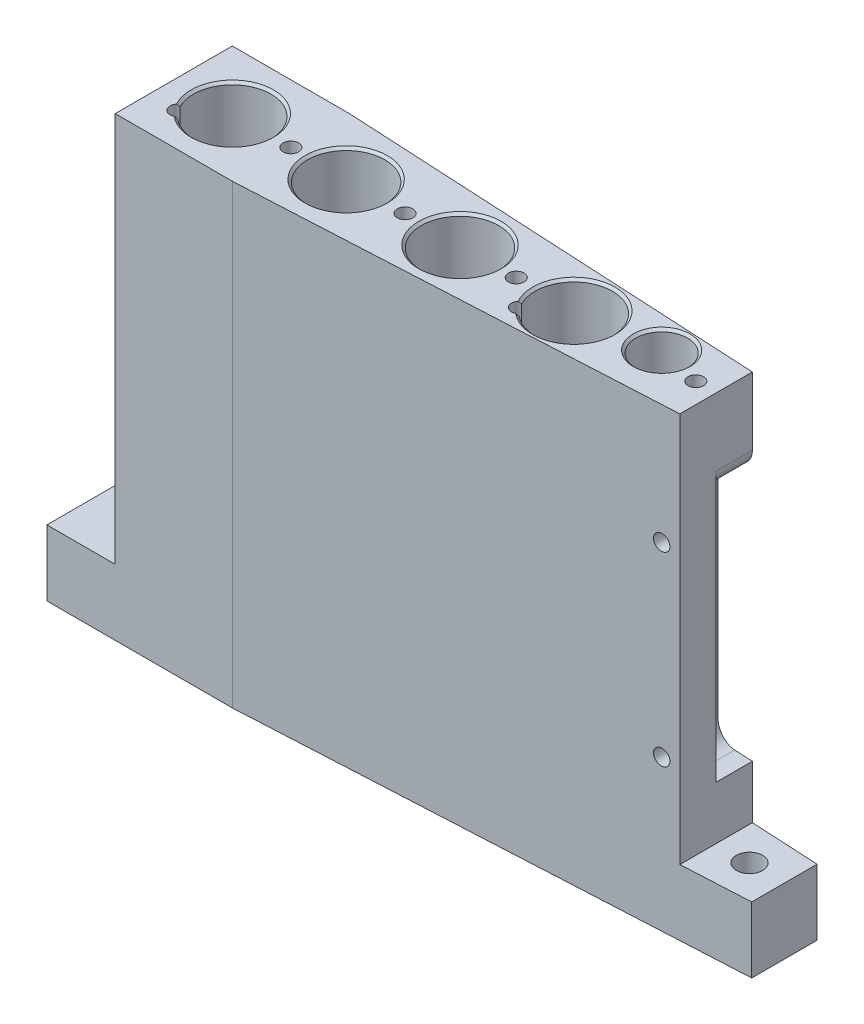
SolidWorks part; units mm, degrees
ref_plane "Front Plane" through (0, 0, 0) normal (0, 0, 1) x (1, 0, 0)
ref_plane "Top Plane" through (0, 0, 0) normal (0, 1, 0) x (1, 0, 0)
ref_plane "Right Plane" through (0, 0, 0) normal (1, 0, 0) x (0, 0, -1)
sketch "Sketch1" plane through (0, 0, 0) normal (0, 1, 0) x (1, 0, 0)
  line L0 (0, 6) -> (0, -6)
  line L2 (19.015, -6) -> (69.58, -3.35)
  line L3 (69.58, -3.35) -> (69.58, 3.35)
  line L4 (69.58, 3.35) -> (19.015, 6)
  line L5 (-7.8088, 0) -> (87.9118, 0) construction
  line L6 (-55, 0) -> (55, 0) construction
  line L7 (0, 6) -> (19.015, 6)
  line L8 (0, -6) -> (19.015, -6)
  point P0 (0, 0)
  dimension "D1" = 6
  dimension "D2" = 6.7
  dimension "D3" = 69.58
  dimension "D4" = 12
extrude "Boss-Extrude1" add sketch "Sketch1" along normal blind 46.75
hole_wizard "5/16 (0.3125) Diameter Hole1" positions "Sketch5" profile "Sketch4" hole size "5/16" standard "ANSI Inch"
sketch "Sketch5" plane through (-12.1053, 46.75, 2.0565) normal (0, 1, 0) x (-1, 0, 0)
  line L0 (-12.1053, 4.5435) -> (-12.1053, -8.6565) construction
  line L1 (13.6072, -2.0565) -> (-37.8178, -2.0565) construction
  point P0 (-25.1053, -2.0565)
  dimension "D1" = 13
sketch "Sketch4" plane through (13, 46.75, 0) normal (1, 0, 0) x (0, 0, 1)
  line L0 (0, 0) -> (0, 41)
  line L1 (0, 41) -> (3.9687, 41)
  line L2 (3.9687, 41) -> (3.9687, 0)
  line L5 (3.9687, 0) -> (0, 0)
  line L10 (0, 41) -> (-3.9688, 41) construction
  line L11 (0, -6.35) -> (0, 107.95) construction
  dimension "Hole Dia." = 7.9375
  dimension "Hole Depth" = 41
  dimension "Drill Angle" = 180
pattern_linear "LPattern1" count 4 spacing 11.6667 along (1, 0, 0) of "5/16 (0.3125) Diameter Hole1"
hole_wizard "#4 (0.209) Diameter Hole1" positions "Sketch13" profile "Sketch12" hole size "#4" standard "ANSI Inch"
sketch "Sketch13" plane through (0, 46.75, 0) normal (0, 1, 0) x (-1, 0, 0)
  line L1 (0, 6.6) -> (0, -6.6) construction
  line L2 (25.7125, 0) -> (-25.7125, 0) construction
  point P0 (-56, -1)
  dimension "D1" = 56
  dimension "D2" = 1
sketch "Sketch12" plane through (56, 46.75, -1) normal (1, 0, 0) x (0, 0, 1)
  line L0 (0, 0) -> (0, 46.75)
  line L1 (0, 46.75) -> (2.6543, 46.75)
  line L2 (2.6543, 46.75) -> (2.6543, 0)
  line L5 (2.6543, 0) -> (0, 0)
  line L11 (0, -6.35) -> (0, 107.95) construction
  dimension "Thru Hole Dia." = 5.3086
  dimension "Thru Hole Depth" = 46.75
sketch "Sketch14" plane through (46.75, 46.75, 0) normal (0, -1, 0) x (0, 0, 1)
  line L1 (6, 46.75) -> (6, 27.735) construction
  line L2 (-6, 46.75) -> (6, 46.75)
  line L3 (-6, 46.75) -> (-6, 39.75)
  line L4 (-6, 39.75) -> (6, 39.75)
  line L6 (6, 46.75) -> (6, 39.75)
  line L9 (-3.35, -22.83) -> (-6, 27.735) construction
  line L10 (-3.7169, -15.83) -> (3.7169, -15.83)
  line L11 (-3.7169, -15.83) -> (-3.7169, -22.83)
  line L12 (-3.7169, -22.83) -> (3.7169, -22.83)
  line L13 (3.7169, -15.83) -> (3.7169, -22.83)
  line L14 (3.35, -22.83) -> (-3.35, -22.83) construction
  line L15 (6, 27.735) -> (3.35, -22.83) construction
  dimension "D1" = 7
  dimension "D2" = 7
extrude "Cut-Extrude1" cut sketch "Sketch14" along normal blind 40
hole_wizard "M2.5 Clearance Hole1" positions "Sketch16" profile "Sketch17" hole size "M2.5" standard "Ansi Metric"
sketch "Sketch16" plane through (0, 6.75, 0) normal (0, 1, 0) x (-1, 0, 0)
  line L0 (0, 6.6) -> (0, -6.6) construction
  line L1 (25.7125, 0) -> (-25.7125, 0) construction
  line L2 (0, 6) -> (0, -6) construction
  point P0 (-3.5, 0)
  point P6 (-66, 0)
  dimension "D1" = 3.5
  dimension "D2" = 66
sketch "Sketch17" plane through (3.5, 6.75, 0) normal (1, 0, 0) x (0, 0, 1)
  line L0 (0, 0) -> (0, 6.75)
  line L1 (0, 6.75) -> (1.35, 6.75)
  line L2 (1.35, 6.75) -> (1.35, 0)
  line L5 (1.35, 0) -> (0, 0)
  line L11 (0, -6.35) -> (0, 107.95) construction
  dimension "Thru Hole Dia." = 2.7
  dimension "Thru Hole Depth" = 6.75
hole_wizard "1/16 (0.0625) Diameter Hole1" positions "Sketch23" profile "Sketch22" hole size "1/16" standard "Ansi Inch"
sketch "Sketch23" plane through (0, 0, 0) normal (0, -1, 0) x (1, 0, 0)
  line L1 (0, -6.6) -> (0, 6.6) construction
  line L2 (25.7125, 0) -> (-25.7125, 0) construction
  point P0 (8, 0)
  point P1 (62, 0)
  dimension "D1" = 8
  dimension "D2" = 54
sketch "Sketch22" plane through (8, 0, 0) normal (1, 0, 0) x (0, 0, -1)
  line L0 (0, 0) -> (0, 4.5)
  line L1 (0, 4.5) -> (0.7937, 4.5)
  line L2 (0.7937, 4.5) -> (0.7937, 0)
  line L5 (0.7937, 0) -> (0, 0)
  line L10 (0, 4.5) -> (-0.7938, 4.5) construction
  line L11 (0, -6.35) -> (0, 107.95) construction
  dimension "Hole Dia." = 1.5875
  dimension "Hole Depth" = 4.5
  dimension "Drill Angle" = 180
ref_plane "Plane1" through (0, 0, -1) normal (0, 0, 1) x (1, 0, 0)
hole_wizard "1/16 (0.0625) Diameter Hole2" positions "Sketch32" profile "Sketch31" hole size "1/16" standard "ANSI Inch"
sketch "Sketch32" plane through (0, 46.75, 0) normal (0, 1, 0) x (1, 0, 0)
  line L1 (-25.7125, 0) -> (25.7125, 0) construction
  circle A2 centre (13, 0) radius 3.9687 construction
  circle A4 centre (48, 0) radius 3.9687 construction
  point P0 (9.9176, -2.5)
  point P13 (44.9176, -2.5)
  dimension "D1" = 2.5
sketch "Sketch31" plane through (9.9176, 46.75, 2.5) normal (1, 0, 0) x (0, 0, 1)
  line L0 (0, 0) -> (0, 6.9769)
  line L1 (0, 6.9769) -> (0.7937, 6.5)
  line L2 (0.7937, 6.5) -> (0.7937, 0)
  line L5 (0.7937, 0) -> (0, 0)
  line L10 (0, 6.9769) -> (-0.7938, 6.5) construction
  line L11 (0, -6.35) -> (0, 107.95) construction
  dimension "Hole Dia." = 1.5875
  dimension "Hole Depth" = 6.5
  dimension "Drill Angle" = 118
hole_wizard "M2x0.4 Tapped Hole2" positions "Sketch37" profile "Sketch36" tap size "M2x0.4" standard "ANSI Metric"
sketch "Sketch37" plane through (0, 46.75, 0) normal (0, 1, 0) x (1, 0, 0)
  line L0 (0, -6.6) -> (0, 6.6) construction
  line L1 (-25.7125, 0) -> (25.7125, 0) construction
  point P0 (19, 0)
  point P2 (30.7, 0)
  point P4 (42.1, 0)
  point P6 (60.5, 0)
  dimension "D1" = 19
  dimension "D2" = 30.7
  dimension "D3" = 42.1
  dimension "D4" = 60.5
sketch "Sketch36" plane through (19, 46.75, 0) normal (1, 0, 0) x (0, 0, 1)
  line L0 (0, 0) -> (0, 5.6807)
  line L1 (0, 5.6807) -> (0.8, 5.2)
  line L2 (0.8, 5.2) -> (0.8, 0)
  line L5 (0.8, 0) -> (0, 0)
  line L10 (0, 5.6807) -> (-0.8, 5.2) construction
  line L11 (0, -6.35) -> (0, 107.95) construction
  dimension "Tap Drill Dia." = 1.6
  dimension "Tap Drill Depth" = 5.2
  dimension "Drill Angle" = 118
sketch "Sketch38" plane through (0, 0, 0) normal (0, 0, 1) x (1, 0, 0)
  line L0 (11.1, 12.7956) -> (11.1, 4.6926) construction
  line L1 (0, -6.6) -> (0, 6.6) construction
  line L2 (19.015, 0) -> (69.58, 0) construction
  line L3 (11.1, 10.5812) -> (11.1, 5.8187)
  arc A0 (11.1, 10.5812) -> (11.1, 5.8187) centre (11.1, 8.2) ccw
  dimension "D1" = 2.3813
  dimension "D2" = 11.1
  dimension "D3" = 8.2
revolve "Cut-Revolve2" cut sketch "Sketch38" angle 360 about L0
sketch "Sketch35" [suppressed] plane through (0, 46.75, 0) normal (0, 1, 0) x (1, 0, 0)
  circle A0 centre (47.7, 0) radius 4.191
  dimension "D1" = 8.382
hole_wizard "#37 (0.104) Diameter Hole1" positions "Sketch41" profile "Sketch40" hole size "#37" standard "ANSI Inch"
sketch "Sketch41" plane through (0, 0, 0) normal (0, -1, 0) x (-1, 0, 0)
  line L4 (-38.33, 1.5) -> (-34.33, 1.5) construction
  line L5 (0, 6.6) -> (0, -6.6) construction
  line L8 (-25.7125, 0) -> (25.7125, 0) construction
  point P2 (-26.67, 1.5)
  point P4 (-34.33, 1.5)
  point P6 (-38.33, 1.5)
  point P53 (-36.33, 1.5)
  point P59 (-48.7, 0.8)
  point P63 (-13, 0)
  dimension "D1" = 4
  dimension "D2" = 26.67
  dimension "D3" = 1.5
  dimension "D4" = 48.7
  dimension "D5" = 36.33
  dimension "D6" = 13
  dimension "D7" = 0.8
sketch "Sketch40" plane through (26.67, 0, -1.5) normal (1, 0, 0) x (0, 0, -1)
  line L0 (0, 0) -> (0, 4.7626)
  line L1 (0, 4.7626) -> (1.3208, 4)
  line L2 (1.3208, 4) -> (1.3208, 0)
  line L5 (1.3208, 0) -> (0, 0)
  line L10 (0, 4.7626) -> (-1.3208, 4) construction
  line L11 (0, -6.35) -> (0, 107.95) construction
  dimension "Hole Dia." = 2.6416
  dimension "Hole Depth" = 4
  dimension "Drill Angle" = 120
hole_wizard "1/16 (0.0625) Diameter Hole3" positions "Sketch46" profile "Sketch45" hole size "1/16" standard "ANSI Inch"
sketch "Sketch46" plane through (0, 0, 0) normal (0, -1, 0) x (-1, 0, 0)
  line L0 (-25.7125, 0) -> (25.7125, 0) construction
  line L1 (0, 6.6) -> (0, -6.6) construction
  point P0 (-13, 0)
  dimension "D1" = 13
sketch "Sketch45" plane through (13, 0, 0) normal (1, 0, 0) x (0, 0, -1)
  line L0 (0, 0) -> (0, 5.75)
  line L1 (0, 5.75) -> (0.7937, 5.75)
  line L2 (0.7937, 5.75) -> (0.7937, 0)
  line L5 (0.7937, 0) -> (0, 0)
  line L11 (0, -6.35) -> (0, 107.95) construction
  dimension "Thru Hole Dia." = 1.5875
  dimension "Thru Hole Depth" = 5.75
sketch "Sketch39" plane through (0, 0, 0) normal (0, -1, 0) x (1, 0, 0)
  circle A0 centre (13, 0) radius 2.95
  circle A1 centre (13, 0) radius 1.55
  circle A2 centre (13, 0) radius 1.3208 construction
  circle A4 centre (48.7, -0.8) radius 1.55
  circle A5 centre (48.7, -0.8) radius 2.95
  circle A6 centre (48.7, -0.8) radius 1.3208 construction
  dimension "D1" = 5.9
  dimension "D2" = 1.4
extrude "Cut-Extrude3" cut sketch "Sketch39" against normal blind 0.75
hole_wizard "1/32 (0.03125) Diameter Hole1" positions "Sketch43" profile "Sketch42" hole size "1/32" standard "ANSI Inch"
sketch "Sketch43" plane through (0, 0, 0) normal (0, -1, 0) x (-1, 0, 0)
  circle A0 centre (-48.7, 0.8) radius 1.3208 construction
  point P0 (-38.33, 1.5)
  point P3 (-34.33, 1.5)
  point P6 (-26.67, 1.5)
  point P9 (-48.7, 0.8)
sketch "Sketch42" plane through (38.33, 0, -1.5) normal (1, 0, 0) x (0, 0, -1)
  line L0 (0, 0) -> (0, 5.75)
  line L1 (0, 5.75) -> (0.3969, 5.75)
  line L2 (0.3969, 5.75) -> (0.3969, 0)
  line L5 (0.3969, 0) -> (0, 0)
  line L11 (0, -6.35) -> (0, 107.95) construction
  dimension "Thru Hole Dia." = 0.7937
  dimension "Thru Hole Depth" = 5.75
sketch "Sketch44" plane through (0, 0, 0) normal (0, -1, 0) x (1, 0, 0)
  line L0 (34.33, -1.5) -> (38.33, -1.5) construction
  line L1 (34.33, 0.25) -> (38.33, 0.25)
  line L2 (34.33, -3.25) -> (38.33, -3.25)
  line L3 (34.33, -1.5) -> (38.33, -1.5) construction
  line L4 (34.33, 1.55) -> (38.33, 1.55)
  line L5 (34.33, -4.55) -> (38.33, -4.55)
  arc A0 (34.33, 0.25) -> (34.33, -3.25) centre (34.33, -1.5) ccw
  arc A1 (38.33, -3.25) -> (38.33, 0.25) centre (38.33, -1.5) ccw
  arc A2 (34.33, 1.55) -> (34.33, -4.55) centre (34.33, -1.5) ccw
  arc A3 (38.33, -4.55) -> (38.33, 1.55) centre (38.33, -1.5) ccw
  circle A4 centre (26.67, -1.5) radius 1.55
  circle A5 centre (26.67, -1.5) radius 2.95
  circle A6 centre (26.67, -1.5) radius 1.3208 construction
  point P4 (36.33, -1.5)
  point P9 (36.33, -1.5)
  dimension "D3" = 5.9
  dimension "D4" = 1.4
  dimension "D1" = 3.5
  dimension "D2" = 1.3
extrude "Cut-Extrude4" cut sketch "Sketch44" against normal blind 0.75
chamfer "Chamfer1" distance 0.25 angle 45 5 edges at (56, 46.75, 1.6543) (51.0824, 46.75, -2.5) (36.3333, 46.75, 3.9687) (24.6667, 46.75, 3.9687) (16.0824, 46.75, -2.5)
sketch "Sketch47" plane through (0, 0, 0) normal (0, 0, 1) x (1, 0, 0)
  line L0 (62.58, 6.75) -> (62.58, 46.75) construction
  line L1 (62.58, 38) -> (58.88, 38)
  line L2 (62.58, 38) -> (62.58, 12.2)
  line L3 (62.58, 12.2) -> (58.88, 12.2)
  line L4 (58.88, 38) -> (58.88, 12.2)
  line L5 (6.6, 0) -> (-6.6, 0) construction
  dimension "D1" = 12.2
  dimension "D2" = 38
  dimension "D3" = 3.7
extrude "Cut-Extrude5" cut sketch "Sketch47" against normal through all
hole_wizard "M2x0.4 Tapped Hole3" positions "Sketch49" profile "Sketch48" tap size "M2x0.4" standard "ANSI Metric"
sketch "Sketch49" plane through (0, 0, 0) normal (0, 0, -1) x (-1, 0, 0)
  line L0 (6.6, 0) -> (-6.6, 0) construction
  line L1 (0, 6.6) -> (0, -6.6) construction
  point P0 (-60.815, 34.505)
  point P2 (-60.815, 15.455)
  dimension "D1" = 15.455
  dimension "D2" = 60.815
  dimension "D3" = 34.505
sketch "Sketch48" plane through (60.815, 34.505, 0) normal (1, 0, 0) x (0, 1, 0)
  line L0 (0, 0) -> (0, 3.8094)
  line L1 (0, 3.8094) -> (0.8, 3.8094)
  line L2 (0.8, 3.8094) -> (0.8, 0)
  line L5 (0.8, 0) -> (0, 0)
  line L11 (0, -6.35) -> (0, 107.95) construction
  dimension "Thru Tap Drill Dia." = 1.6
  dimension "Thru Tap Drill Depth" = 3.8094
fillet "Fillet1" radius 1.8 3 edges at (58.88, 38, -1.9554) (58.88, 12.2, -1.9554) (62.58, 38, -1.8584)
sketch "Sketch50" plane through (0, 0, 0) normal (0, 0, 1) x (1, 0, 0)
  line L0 (12.2063, 4.3043) -> (11.6792, 4) construction
  line L2 (26.2731, 4.5334) -> (25.3492, 4) construction
  line L3 (27.9908, 4) -> (27.0669, 4.5334) construction
  line L4 (27.9908, 4) -> (27.0669, 4.5334) construction
  line L5 (26.2731, 4.5334) -> (25.3492, 4) construction
  line L6 (12.2063, 4.3043) -> (11.6792, 4) construction
  line L7 (14.3208, 4) -> (13.7937, 4.3043) construction
  line L8 (14.3208, 4) -> (13.7937, 4.3043) construction
  point P0 (0, 46.727)
  point P2 (0, 0)
  point P3 (28.2612, 4.6027)
  dimension "D1" = 2.6416
  dimension "D2" = 0.7937
  dimension "D3" = 120
  dimension "D4" = 2.6416
  dimension "D5" = 1.5875
  dimension "D6" = 120
sketch "Sketch51" plane through (0, 0, 0) normal (0, 0, 1) x (1, 0, 0)
  line L0 (58.9043, 46.75) -> (53.0957, 46.75) construction
  line L1 (60.815, 34.505) -> (60.815, 15.455) construction
  circle A0 centre (60.815, 34.505) radius 0.8 construction
  point P0 (0, 46.75)
  dimension "D2" = 19.05
  dimension "D1" = 60.815
  dimension "D3" = 12.245
